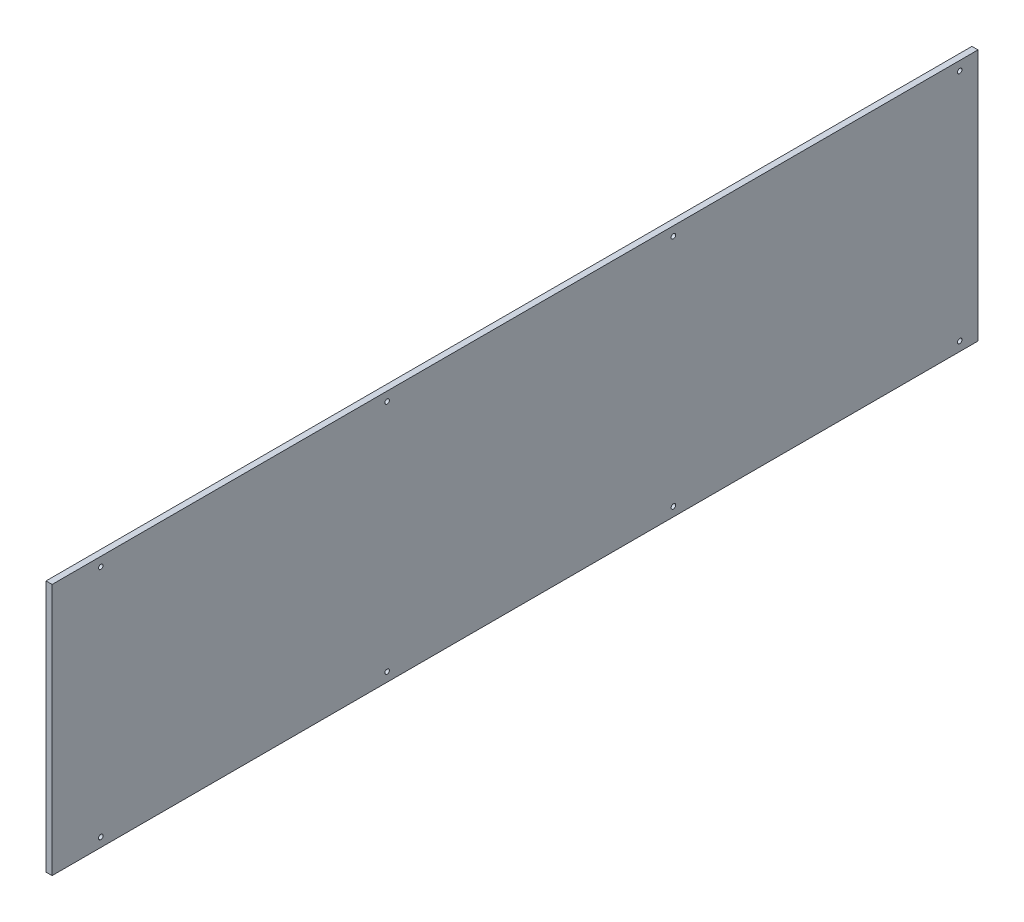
SolidWorks part; units mm, degrees
ref_plane "Front Plane" through (0, 0, 0) normal (0, 0, 1) x (1, 0, 0)
ref_plane "Top Plane" through (0, 0, 0) normal (0, 1, 0) x (1, 0, 0)
ref_plane "Right Plane" through (0, 0, 0) normal (1, 0, 0) x (0, 0, -1)
sketch "Sketch1" plane through (0, 0, 0) normal (1, 0, 0) x (0, 0, -1)
  line L1 (0, 0) -> (1930.4, 0)
  line L2 (0, 0) -> (0, 525.78)
  line L3 (0, 525.78) -> (1930.4, 525.78)
  line L4 (1930.4, 0) -> (1930.4, 525.78)
  dimension "D1" = 1930.4
  dimension "D2" = 525.78
extrude "Extrude1" add sketch "Sketch1" against normal blind 12.7
sketch "Sketch2" plane through (0, 0, 0) normal (1, 0, 0) x (0, 0, -1)
  line L0 (1930.4, 525.78) -> (0, 525.78) construction
  line L1 (0, 525.78) -> (0, 0) construction
  line L2 (0, 262.89) -> (1949.4914, 262.89) construction
  circle A0 centre (101.6, 506.73) radius 4.7625
  circle A1 centre (101.6, 19.05) radius 4.7625
  dimension "D1" = 9.525
  dimension "D2" = 19.05
  dimension "D3" = 101.6
extrude "barrel nuts" cut sketch "Sketch2" against normal through all
pattern_linear "LPattern1" count 4 spacing 596.9 along (0, 0, -1) of "barrel nuts"
